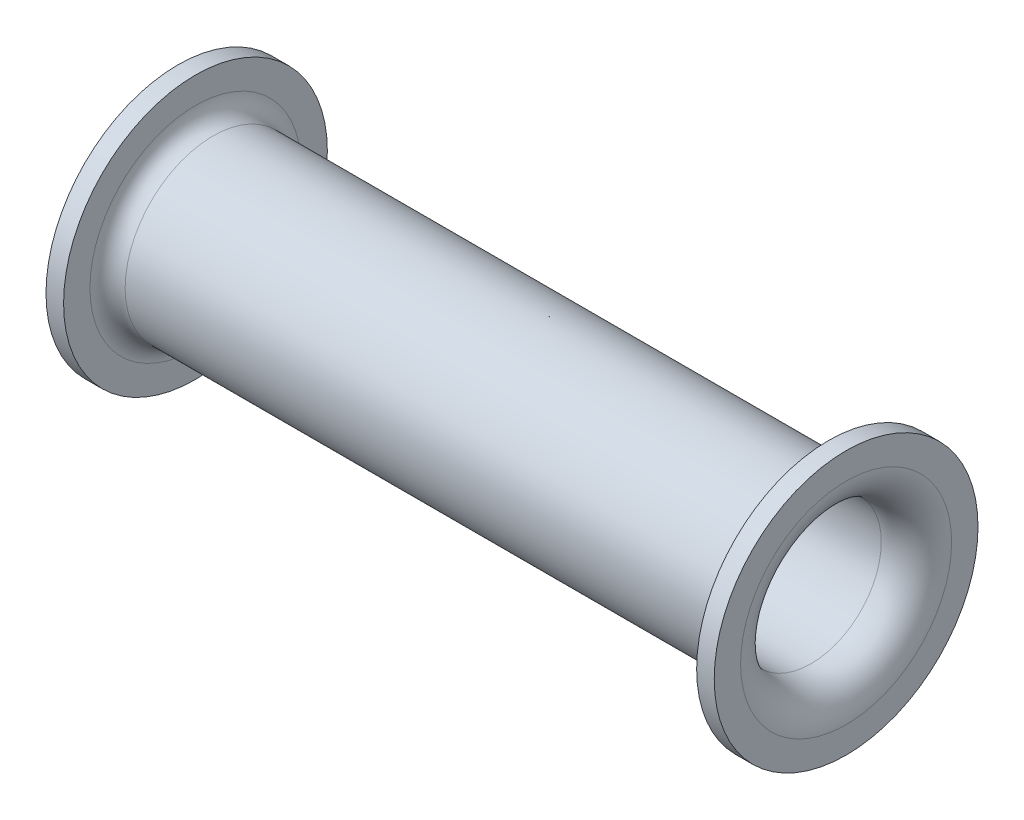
SolidWorks part; units mm, degrees
ref_plane "Plane1" through (0, 0, 0) normal (0, 0, 1) x (1, 0, 0)
ref_plane "Plane2" through (0, 0, 0) normal (0, 1, 0) x (1, 0, 0)
ref_plane "Plane3" through (0, 0, 0) normal (1, 0, 0) x (0, 0, -1)
sketch "Sketch1" plane through (0, 0, 0) normal (0, 0, 1) x (1, 0, 0)
  line L0 (-20, 0) -> (20, 0) construction
  line L2 (-20, 4) -> (20, 4)
  line L3 (-20, 4) -> (-20, 5)
  line L4 (-20, 5) -> (20, 5)
  line L5 (20, 4) -> (20, 5)
  dimension "D1" = 20
  dimension "Length" = 40
  dimension "WallThickness" = 1
  dimension "Diameter" = 10
revolve "Base-Revolve" add sketch "Sketch1" angle 360 about L0
sketch "Sketch2" plane through (0, 0, 0) normal (0, 0, 1) x (1, 0, 0)
  line L0 (-30, 0) -> (30, 0) construction
  line L1 (-20, 5) -> (-20, -5) construction
  line L2 (-20, 0) -> (-17, 0)
  line L3 (-20, 0) -> (-20, 6)
  line L4 (-20, 6) -> (-17, 6)
  line L5 (-17, 0) -> (-17, 6)
  line L6 (17, 0) -> (20, 0)
  line L7 (17, 0) -> (17, 6)
  line L8 (17, 6) -> (20, 6)
  line L9 (20, 0) -> (20, 6)
  line L10 (20, -5) -> (20, 5) construction
  point P15 (-18, 6)
  point P16 (18, 6)
  dimension "D1" = 18
  dimension "GripLength" = 36
  dimension "D2" = 1
  dimension "D3" = 34
  dimension "D4" = 12
  dimension "CutByR" = 1
revolve "Cut-for-GripLength" cut sketch "Sketch2" angle 360 about L0
sketch "Sketch3" plane through (0, 0, 0) normal (0, 0, 1) x (1, 0, 0)
  line L0 (17, -5) -> (17, 5) construction
  line L1 (-19, 6) -> (-19, 7.5)
  line L2 (-19, 7.5) -> (-18, 7.5)
  line L3 (-18, 7.5) -> (-18, 6)
  line L4 (-17, 5) -> (-17, -5) construction
  line L5 (-17, 5) -> (-17, 4)
  line L6 (17, 5) -> (-17, 5) construction
  line L7 (17, 4) -> (-17, 4) construction
  line L9 (-20, 0) -> (19, 0) construction
  line L10 (-20, 0) -> (20, 0) construction
  line L12 (19, 6) -> (19, 7.5)
  line L13 (19, 7.5) -> (18, 7.5)
  line L14 (18, 7.5) -> (18, 6)
  line L16 (17, 5) -> (17, 4)
  arc A0 (-18, 6) -> (-17, 5) centre (-17, 6) ccw
  arc A1 (-19, 6) -> (-17, 4) centre (-17, 6) ccw
  arc A2 (17, 5) -> (18, 6) centre (17, 6) ccw
  arc A3 (17, 4) -> (19, 6) centre (17, 6) ccw
  dimension "D1" = 1
  dimension "HeadFillet" = 1
  dimension "D3" = 1
  dimension "D2" = 1
  dimension "HeadDia" = 15
revolve "HeadTypeA" add sketch "Sketch3" angle 360 about L9
sketch "Sketch4" plane through (0, 0, 0) normal (0, 0, 1) x (1, 0, 0)
  line L0 (-18, 5) -> (-17, 5)
  line L1 (-18, 6.5) -> (-18, 7.5)
  line L2 (0, 0) -> (0, 10) construction
  line L3 (-17, 5) -> (-17, 4)
  line L4 (-17, 4) -> (-18, 4)
  line L5 (17, 4) -> (18, 4)
  line L6 (17, 5) -> (17, 4)
  line L7 (18, 6.5) -> (18, 7.5)
  line L8 (18, 5) -> (17, 5)
  line L10 (-20, 0) -> (20, 0) construction
  line L11 (-20, 0) -> (20, 0) construction
  arc A0 (-18, 6.5) -> (-18, 5) centre (-18, 5.75) ccw
  arc A1 (-18, 7.5) -> (-18, 4) centre (-18, 5.75) ccw
  arc A2 (18, 7.5) -> (18, 4) centre (18, 5.75) cw
  arc A3 (18, 6.5) -> (18, 5) centre (18, 5.75) cw
  dimension "D1" = 15
  dimension "D5" = 34
  dimension "D2" = 1
  dimension "D3" = 10
  dimension "D4" = 1
revolve "HeadTypeB" [suppressed] add sketch "Sketch4" angle 360 about L10
equation "\"D1@Sketch1\" = \"Length@Sketch1\" / 2"
equation "\"D4@Sketch2\" = \"Diameter@Sketch1\" + 2"
equation "\"D1@Sketch3\" = \"WallThickness@Sketch1\""
equation "\"D2@Sketch3\" = \"D1@Sketch3\""
equation "\"D3@Sketch3\" = \"HeadFillet@Sketch3\""
equation "\"D4@Sketch4\" = \"WallThickness@Sketch1\""
equation "\"D1@Sketch4\" = \"HeadDia@Sketch3\""
equation "\"D2@Sketch4\" = \"HeadFillet@Sketch3\""
equation "\"D3@Sketch4\" = \"Diameter@Sketch1\""
equation "\"D1@Sketch2\" = \"GripLength@Sketch2\" / 2"
equation "\"D2@Sketch2\" = \"CutByR@Sketch2\""
equation "\"D5@Sketch4\" = \"D3@Sketch2\""
